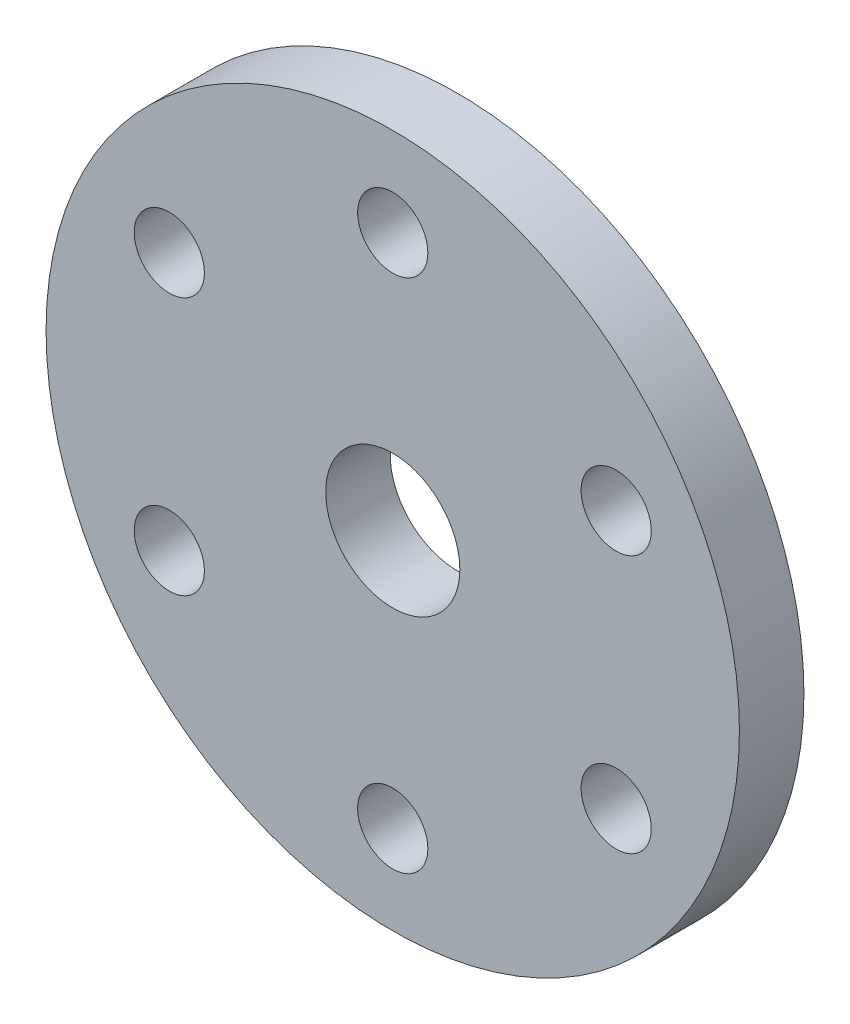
SolidWorks part; units mm, degrees
ref_plane "Front" through (0, 0, 0) normal (0, 0, 1) x (1, 0, 0)
ref_plane "Top" through (0, 0, 0) normal (0, 1, 0) x (1, 0, 0)
ref_plane "Right" through (0, 0, 0) normal (1, 0, 0) x (0, 0, -1)
sketch "Sketch1" plane through (0, 0, 0) normal (0, 0, 1) x (1, 0, 0)
  circle A0 centre (0, 0) radius 17.0656
  circle A1 centre (0, 0) radius 3.302
  dimension "D1" = 34.1313
  dimension "D2" = 6.604
extrude "Extrude1" add sketch "Sketch1" along normal blind 3.175
hole_wizard "#29 (0.136) Diameter Hole1" positions "Sketch3" profile "Sketch2" hole size "#29" standard "Ansi Inch"
sketch "Sketch3" plane through (0, 0, 3.175) normal (0, 0, 1) x (1, 0, 0)
  line L0 (0, 0) -> (0, 12.7) construction
  line L1 (0, 0) -> (10.9985, 6.35) construction
  circle A0 centre (0, 0) radius 12.7 construction
  point P0 (0, 12.7)
  point P23 (10.9985, 6.35)
  point P24 (10.9985, -6.35)
  point P25 (0, -12.7)
  point P26 (-10.9985, -6.35)
  point P27 (-10.9985, 6.35)
  dimension "D1" = 25.4
  dimension "D2" = 60
  dimension "D3" = 12.7
sketch "Sketch2" plane through (0, 12.7, 3.175) normal (1, 0, 0) x (0, -1, 0)
  line L0 (0, 0) -> (0, 3.175)
  line L1 (0, 3.175) -> (1.7272, 3.175)
  line L2 (1.7272, 3.175) -> (1.7272, 0)
  line L5 (1.7272, 0) -> (0, 0)
  line L11 (0, -6.35) -> (0, 107.95) construction
  dimension "Thru Hole Dia." = 3.4544
  dimension "Thru Hole Depth" = 3.175
